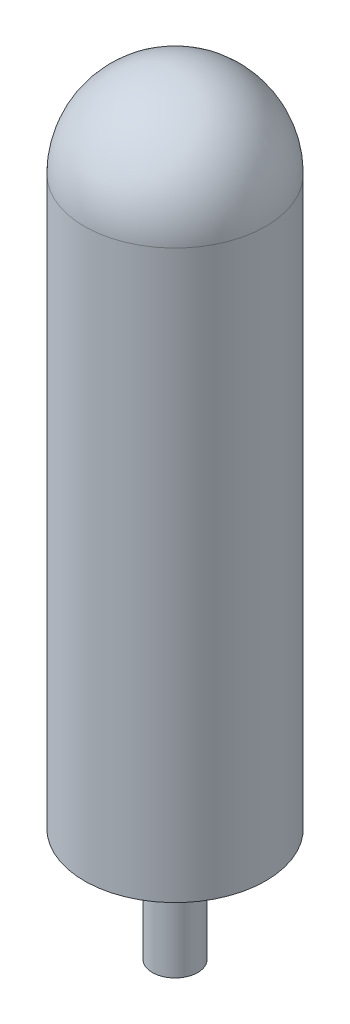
SolidWorks part; units mm, degrees
ref_plane "Front Plane" through (0, 0, 0) normal (0, 0, 1) x (1, 0, 0)
ref_plane "Top Plane" through (0, 0, 0) normal (0, 1, 0) x (1, 0, 0)
ref_plane "Right Plane" through (0, 0, 0) normal (1, 0, 0) x (0, 0, -1)
sketch "Sketch1" plane through (0, 0, 0) normal (0, 0, 1) x (1, 0, 0)
  line L0 (0, 0) -> (2, 0)
  line L1 (2, 0) -> (2, 10)
  line L2 (2, 10) -> (8, 10)
  line L3 (8, 10) -> (8, 60)
  line L4 (0, 68) -> (0, 0) construction
  line L5 (0, 60) -> (8, 60) construction
  line L6 (0, 0) -> (0, 68)
  arc A0 (8, 60) -> (0, 68) centre (0, 60) ccw
  dimension "D1" = 2
  dimension "D2" = 6
  dimension "D3" = 50
  dimension "D4" = 10
revolve "Revolve1" add sketch "Sketch1" angle 360 about L6
